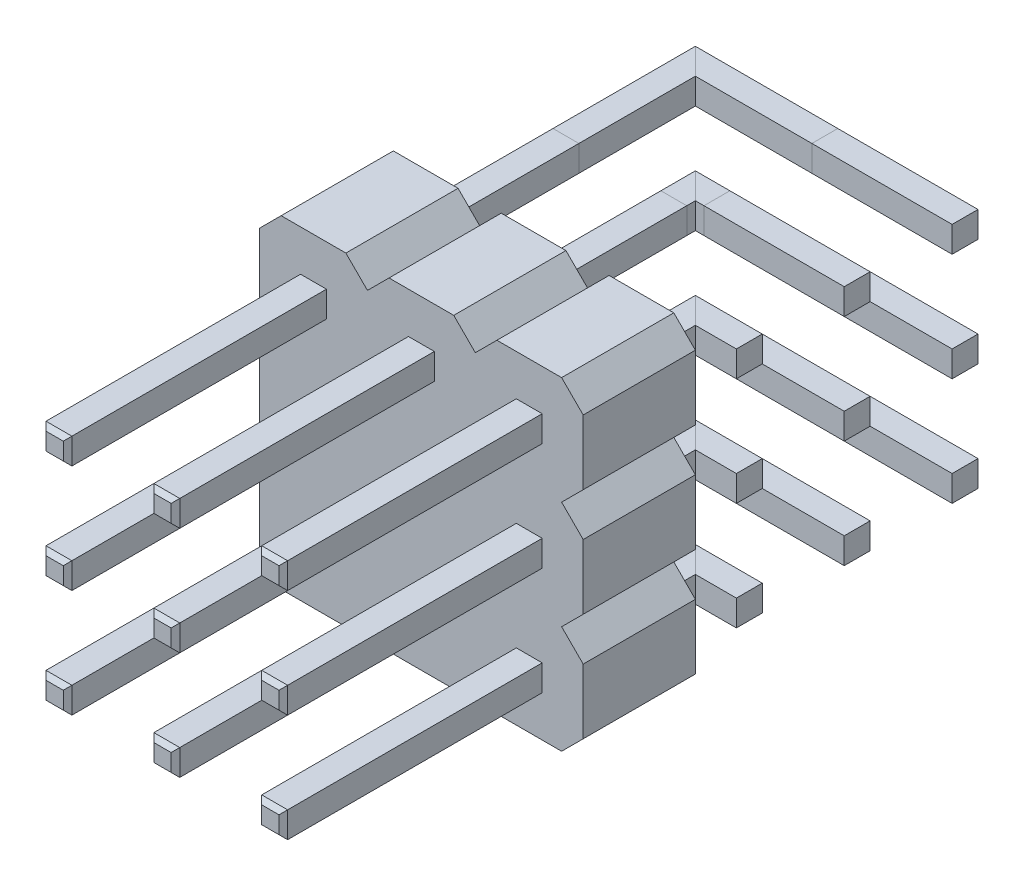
SolidWorks part; units mm, degrees
ref_plane "前视基准面" through (0, 0, 0) normal (0, 0, 1) x (1, 0, 0)
ref_plane "上视基准面" through (0, 0, 0) normal (0, 1, 0) x (1, 0, 0)
ref_plane "右视基准面" through (0, 0, 0) normal (1, 0, 0) x (0, 0, -1)
sketch "草图1" plane through (0, 0, 0) normal (0, 0, 1) x (1, 0, 0)
  line L0 (-9.2092, 0) -> (7.9592, 0) construction
  line L1 (0, 7.3852) -> (0, -7.3852) construction
  line L2 (-3.75, 3.25) -> (-3.25, 3.75)
  line L3 (-3.25, 3.75) -> (-1.75, 3.75)
  line L4 (-3.75, 3.25) -> (-3.75, 1.75)
  line L5 (-3.25, 1.25) -> (-1.75, 1.25)
  line L6 (-1.25, 3.25) -> (-1.25, 1.75)
  line L7 (-3.75, 3.75) -> (-1.25, 1.25) construction
  line L8 (-3.75, 1.25) -> (-1.25, 3.75) construction
  line L9 (-1.75, 3.75) -> (-1.25, 3.25)
  line L10 (-1.75, 1.25) -> (-1.25, 1.75)
  line L11 (-3.75, 1.75) -> (-3.25, 1.25)
  line L12 (-1.25, 3.25) -> (-0.75, 3.75)
  line L13 (-0.75, 3.75) -> (0.75, 3.75)
  line L14 (0.75, 3.75) -> (1.25, 3.25)
  line L15 (1.25, 3.25) -> (1.25, 1.75)
  line L16 (0.75, 1.25) -> (1.25, 1.75)
  line L17 (-0.75, 1.25) -> (0.75, 1.25)
  line L18 (-1.25, 1.75) -> (-0.75, 1.25)
  line L19 (-1.25, 3.25) -> (-1.25, 1.75)
  line L20 (1.25, 3.25) -> (1.75, 3.75)
  line L21 (1.75, 3.75) -> (3.25, 3.75)
  line L22 (3.25, 3.75) -> (3.75, 3.25)
  line L23 (3.75, 3.25) -> (3.75, 1.75)
  line L24 (3.25, 1.25) -> (3.75, 1.75)
  line L25 (1.75, 1.25) -> (3.25, 1.25)
  line L26 (1.25, 1.75) -> (1.75, 1.25)
  line L27 (1.25, 3.25) -> (1.25, 1.75)
  line L28 (-1.25, 0.75) -> (-0.75, 1.25)
  line L29 (-0.75, 1.25) -> (0.75, 1.25)
  line L30 (0.75, 1.25) -> (1.25, 0.75)
  line L31 (1.25, 0.75) -> (1.25, -0.75)
  line L32 (0.75, -1.25) -> (1.25, -0.75)
  line L33 (-0.75, -1.25) -> (0.75, -1.25)
  line L34 (-1.25, -0.75) -> (-0.75, -1.25)
  line L35 (-1.25, 0.75) -> (-1.25, -0.75)
  line L36 (1.25, 0.75) -> (1.75, 1.25)
  line L37 (1.75, 1.25) -> (3.25, 1.25)
  line L38 (3.25, 1.25) -> (3.75, 0.75)
  line L39 (3.75, 0.75) -> (3.75, -0.75)
  line L40 (3.25, -1.25) -> (3.75, -0.75)
  line L41 (1.75, -1.25) -> (3.25, -1.25)
  line L42 (1.25, -0.75) -> (1.75, -1.25)
  line L43 (1.25, 0.75) -> (1.25, -0.75)
  line L44 (-1.25, -1.75) -> (-0.75, -1.25)
  line L45 (-0.75, -1.25) -> (0.75, -1.25)
  line L46 (0.75, -1.25) -> (1.25, -1.75)
  line L47 (1.25, -1.75) -> (1.25, -3.25)
  line L48 (0.75, -3.75) -> (1.25, -3.25)
  line L49 (-0.75, -3.75) -> (0.75, -3.75)
  line L50 (-1.25, -3.25) -> (-0.75, -3.75)
  line L51 (-1.25, -1.75) -> (-1.25, -3.25)
  line L52 (1.25, -1.75) -> (1.75, -1.25)
  line L53 (1.75, -1.25) -> (3.25, -1.25)
  line L54 (3.25, -1.25) -> (3.75, -1.75)
  line L55 (3.75, -1.75) -> (3.75, -3.25)
  line L56 (3.25, -3.75) -> (3.75, -3.25)
  line L57 (1.75, -3.75) -> (3.25, -3.75)
  line L58 (1.25, -3.25) -> (1.75, -3.75)
  line L59 (1.25, -1.75) -> (1.25, -3.25)
  line L60 (-3.75, 0.75) -> (-3.25, 1.25)
  line L61 (-3.25, 1.25) -> (-1.75, 1.25)
  line L62 (-1.75, 1.25) -> (-1.25, 0.75)
  line L63 (-1.25, 0.75) -> (-1.25, -0.75)
  line L64 (-1.75, -1.25) -> (-1.25, -0.75)
  line L65 (-3.25, -1.25) -> (-1.75, -1.25)
  line L66 (-3.75, -0.75) -> (-3.25, -1.25)
  line L67 (-3.75, 0.75) -> (-3.75, -0.75)
  line L68 (-3.75, -1.75) -> (-3.25, -1.25)
  line L69 (-3.25, -1.25) -> (-1.75, -1.25)
  line L70 (-1.75, -1.25) -> (-1.25, -1.75)
  line L71 (-1.25, -1.75) -> (-1.25, -3.25)
  line L72 (-1.75, -3.75) -> (-1.25, -3.25)
  line L73 (-3.25, -3.75) -> (-1.75, -3.75)
  line L74 (-3.75, -3.25) -> (-3.25, -3.75)
  line L75 (-3.75, -1.75) -> (-3.75, -3.25)
  point P5 (-2.5, 2.5)
  dimension "D1" = 2.5
  dimension "D2" = 2.5
  dimension "D3" = 1.25
  dimension "D4" = 1.25
  dimension "D9" = 3
  dimension "D10" = 3
extrude "凸台-拉伸1" add sketch "草图1" along normal blind 2.6 contours L4 L11 L5 L10 L6 L9 L3 L2 | L6 L18 L17 L16 L15 L14 L13 L12 | L15 L26 L25 L24 L23 L22 L21 L20 | L31 L42 L41 L40 L39 L38 L25 L36 | L47 L58 L57 L56 L55 L54 L41 L52 | L28 L35 L34 L33 L32 L31 L30 L17 | L44 L51 L50 L49 L48 L47 L46 L33 | L68 L75 L74 L73 L72 L51 L70 L65 | L60 L67 L66 L65 L64 L35 L62 L5
ref_plane "基准面1" through (3.75, 0, 0) normal (-1, 0, 0) x (0, 0, 1)
sketch "草图2" plane through (3.75, 0, 0) normal (-1, 0, 0) x (0, 0, 1)
  line L0 (-12.5514, 0) -> (13.0178, 0) construction
  line L1 (0, 3.25) -> (0, 1.75) construction
  line L2 (-1.55, 2.8) -> (-0.95, 2.8)
  line L3 (-1.55, 2.8) -> (-1.55, 2.2)
  line L4 (-1.55, 2.2) -> (-0.95, 2.2)
  line L5 (-0.95, 2.8) -> (-0.95, 2.2)
  line L6 (-1.55, 2.8) -> (-0.95, 2.2) construction
  line L7 (-1.55, 2.2) -> (-0.95, 2.8) construction
  line L8 (-4.05, 2.8) -> (-3.45, 2.8)
  line L9 (-4.05, 2.8) -> (-4.05, 2.2)
  line L10 (-3.45, 2.8) -> (-3.45, 2.2)
  line L11 (-4.05, 2.2) -> (-3.45, 2.2)
  line L12 (-6.55, 2.8) -> (-5.95, 2.8)
  line L13 (-6.55, 2.8) -> (-6.55, 2.2)
  line L14 (-5.95, 2.8) -> (-5.95, 2.2)
  line L15 (-6.55, 2.2) -> (-5.95, 2.2)
  line L16 (-4.05, 0.3) -> (-3.45, 0.3)
  line L17 (-4.05, 0.3) -> (-4.05, -0.3)
  line L18 (-3.45, 0.3) -> (-3.45, -0.3)
  line L19 (-4.05, -0.3) -> (-3.45, -0.3)
  line L20 (-6.55, 0.3) -> (-5.95, 0.3)
  line L21 (-6.55, 0.3) -> (-6.55, -0.3)
  line L22 (-5.95, 0.3) -> (-5.95, -0.3)
  line L23 (-6.55, -0.3) -> (-5.95, -0.3)
  line L24 (-4.05, -2.2) -> (-3.45, -2.2)
  line L25 (-4.05, -2.2) -> (-4.05, -2.8)
  line L26 (-3.45, -2.2) -> (-3.45, -2.8)
  line L27 (-4.05, -2.8) -> (-3.45, -2.8)
  line L28 (-6.55, -2.2) -> (-5.95, -2.2)
  line L29 (-6.55, -2.2) -> (-6.55, -2.8)
  line L30 (-5.95, -2.2) -> (-5.95, -2.8)
  line L31 (-6.55, -2.8) -> (-5.95, -2.8)
  line L32 (-1.55, 0.3) -> (-0.95, 0.3)
  line L33 (-1.55, 0.3) -> (-1.55, -0.3)
  line L34 (-0.95, 0.3) -> (-0.95, -0.3)
  line L35 (-1.55, -0.3) -> (-0.95, -0.3)
  line L36 (-1.55, -2.2) -> (-0.95, -2.2)
  line L37 (-1.55, -2.2) -> (-1.55, -2.8)
  line L38 (-0.95, -2.2) -> (-0.95, -2.8)
  line L39 (-1.55, -2.8) -> (-0.95, -2.8)
  point P3 (-1.25, 2.5)
  dimension "D1" = 0.6
  dimension "D2" = 0.6
  dimension "D3" = 1.25
  dimension "D4" = 2.5
  dimension "D5" = 3
  dimension "D6" = 3
sketch "草图3" plane through (0, 0, 0) normal (0, 1, 0) x (1, 0, 0)
  line L0 (3.8887, 3.75) -> (0.5, 3.75)
  line L1 (0, 3.25) -> (0, -8.6)
  line L6 (-3.25, -2.6) -> (-1.75, -2.6) construction
  line L7 (1.75, 0) -> (3.25, 0) construction
  line L8 (0.5, 3.75) -> (0, 3.75)
  line L9 (0, 3.75) -> (0, 3.25)
  dimension "D1" = 6
  dimension "D2" = 3.75
sweep "扫描1" add profiles "草图2" path "草图3"
chamfer "倒角1" distance 0.1 angle 45 36 edges at (-2.8, 2.5, 8.6) (-2.5, 2.8, 8.6) (-2.2, 2.5, 8.6) (-2.5, 2.2, 8.6) (2.2, -2.5, 8.6) (2.5, -2.2, 8.6) (2.8, -2.5, 8.6) (2.5, -2.8, 8.6) (2.2, 0, 8.6) (2.5, 0.3, 8.6) (2.8, 0, 8.6) (2.5, -0.3, 8.6) (-0.3, -2.5, 8.6) (0, -2.2, 8.6) (0.3, -2.5, 8.6) (0, -2.8, 8.6) (-2.8, -2.5, 8.6) (-2.5, -2.2, 8.6) (-2.2, -2.5, 8.6) (-2.5, -2.8, 8.6) (-2.8, 0, 8.6) (-2.5, 0.3, 8.6) (-2.2, 0, 8.6) (-2.5, -0.3, 8.6) (-0.3, 0, 8.6) (0, 0.3, 8.6) (0.3, 0, 8.6) (0, -0.3, 8.6) (2.5, 2.2, 8.6) (2.2, 2.5, 8.6) (2.5, 2.8, 8.6) (2.8, 2.5, 8.6) (-0.3, 2.5, 8.6) (0, 2.8, 8.6) (0.3, 2.5, 8.6) (0, 2.2, 8.6)
